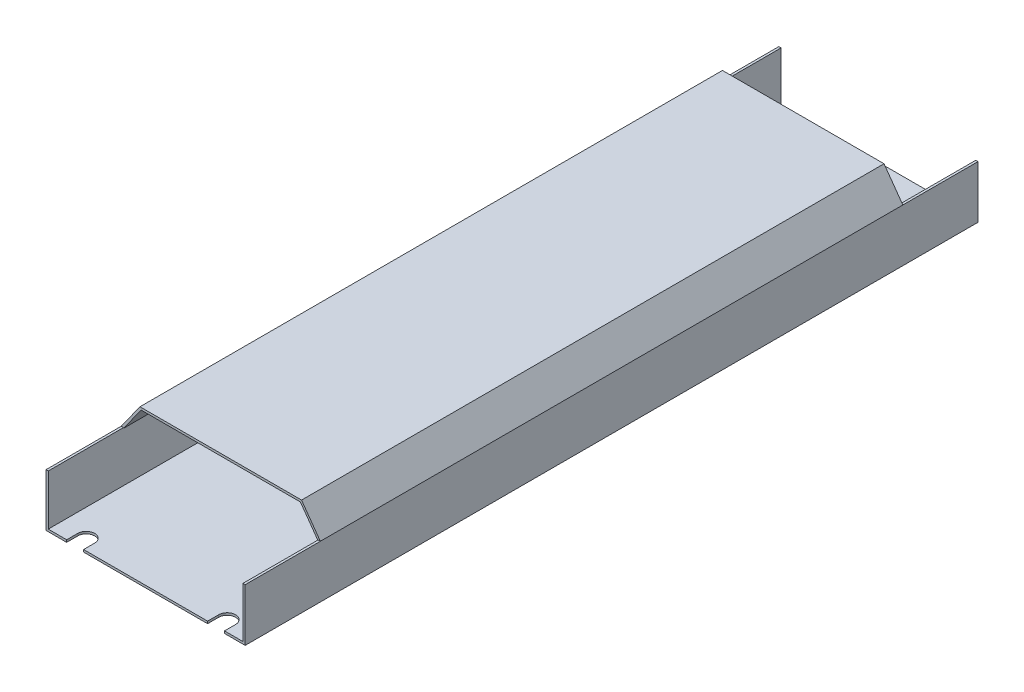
SolidWorks part; units mm, degrees
ref_plane "Plan de face" through (0, 0, 0) normal (0, 0, 1) x (1, 0, 0)
ref_plane "Plan de dessus" through (0, 0, 0) normal (0, 1, 0) x (1, 0, 0)
ref_plane "Plan de droite" through (0, 0, 0) normal (1, 0, 0) x (0, 0, -1)
sketch "Esquisse3" plane through (0, 0, 0) normal (0, 0, 1) x (1, 0, 0)
  line L0 (-26.5, 0) -> (26.5, 0)
  line L1 (26.5, 0) -> (26.5, 14)
  line L3 (-26.5, 14) -> (-26.5, 0)
  point P4 (0, 0)
  dimension "D1" = 53
  dimension "D2" = 14
extrude "Extru.-Mince1" add sketch "Esquisse3" along normal mid plane 195 thin
sketch "Esquisse4" plane through (0, 0, 0) normal (0, -1, 0) x (1, 0, 0)
  line L0 (18.75, 100.45) -> (18.75, 94.55) construction
  line L1 (-26.5, 97.5) -> (26.5, 97.5) construction
  line L2 (21, 100.45) -> (21, 94.55)
  line L3 (16.5, 100.45) -> (16.5, 94.55)
  line L4 (0, -55) -> (0, 55) construction
  line L5 (-18.75, 100.45) -> (-18.75, 94.55) construction
  line L6 (-21, 100.45) -> (-21, 94.55)
  line L7 (-16.5, 100.45) -> (-16.5, 94.55)
  arc A0 (21, 100.45) -> (16.5, 100.45) centre (18.75, 100.45) ccw
  arc A1 (16.5, 94.55) -> (21, 94.55) centre (18.75, 94.55) ccw
  arc A2 (-21, 100.45) -> (-16.5, 100.45) centre (-18.75, 100.45) cw
  arc A3 (-16.5, 94.55) -> (-21, 94.55) centre (-18.75, 94.55) cw
  point P4 (18.75, 97.5)
  point P14 (-18.75, 97.5)
  dimension "D2" = 5.2
  dimension "D1" = 4.5
  dimension "D3" = 16.5
extrude "Enlèv. mat.-Extru.1" cut sketch "Esquisse4" against normal up to next
mirror "Symétrie1" about plane through (0, 0, 0) normal (0, 0, 1) of "Enlèv. mat.-Extru.1"
sketch "Esquisse5" plane through (0, 0, 0) normal (0, 0, 1) x (1, 0, 0)
  line L0 (-26.5, 14) -> (-21.5, 21)
  line L1 (-21.5, 21) -> (21.5, 21)
  line L2 (21.5, 21) -> (26.5, 14)
  point P8 (0, 21)
  dimension "D1" = 43
  dimension "D2" = 21
extrude "Extru.-Mince2" add sketch "Esquisse5" along normal mid plane 155 thin
